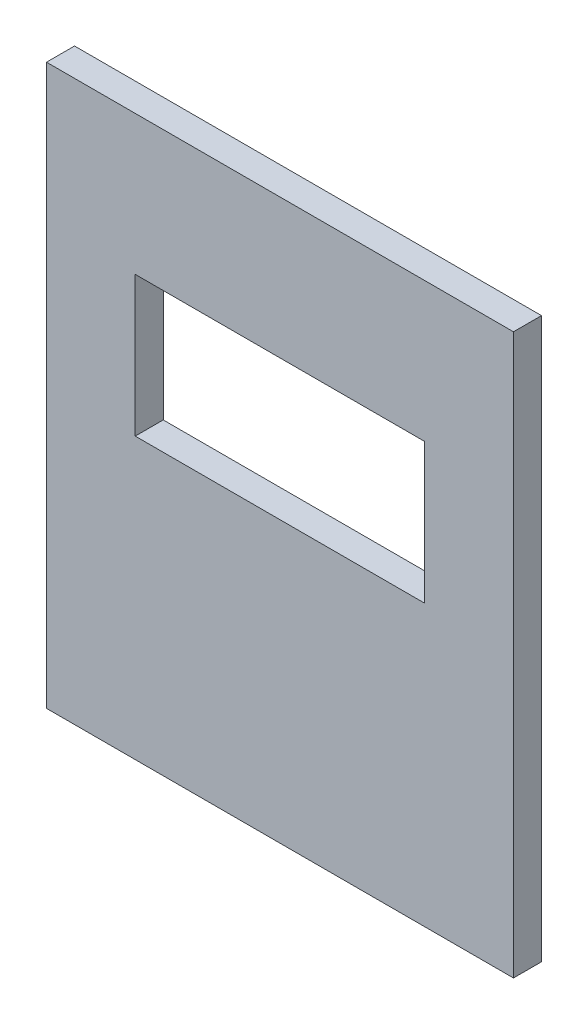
SolidWorks part; units mm, degrees
ref_plane "Plan de face" through (0, 0, 0) normal (0, 0, 1) x (1, 0, 0)
ref_plane "Plan de dessus" through (0, 0, 0) normal (0, 1, 0) x (1, 0, 0)
ref_plane "Plan de droite" through (0, 0, 0) normal (1, 0, 0) x (0, 0, -1)
sketch "Esquisse1" plane through (0, 0, 0) normal (0, 0, 1) x (1, 0, 0)
  line L1 (-33.8238, 27.2685) -> (16.1762, 27.2685)
  line L2 (-33.8238, 27.2685) -> (-33.8238, -32.6574)
  line L3 (-33.8238, -32.6574) -> (16.1762, -32.6574)
  line L4 (16.1762, 27.2685) -> (16.1762, -32.6574)
  line L5 (-24.3238, 12.3426) -> (6.6762, 12.3426)
  line L6 (-24.3238, 12.3426) -> (-24.3238, -2.6574)
  line L7 (-24.3238, -2.6574) -> (6.6762, -2.6574)
  line L8 (6.6762, 12.3426) -> (6.6762, -2.6574)
  dimension "D1" = 31
  dimension "D2" = 15
  dimension "D3" = 9.5
  dimension "D4" = 9.5
  dimension "D5" = 30
extrude "Boss.-Extru.1" add sketch "Esquisse1" along normal blind 3
